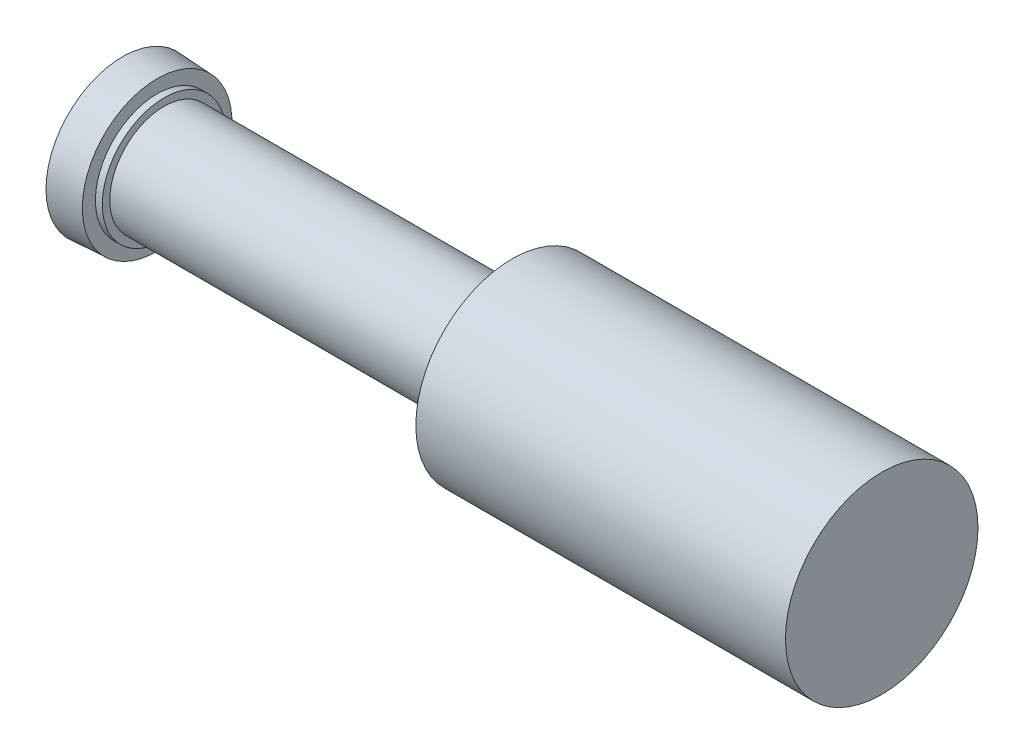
SolidWorks part; units mm, degrees
ref_plane "Front Plane" through (0, 0, 0) normal (0, 0, 1) x (1, 0, 0)
ref_plane "Top Plane" through (0, 0, 0) normal (0, 1, 0) x (1, 0, 0)
ref_plane "Right Plane" through (0, 0, 0) normal (1, 0, 0) x (0, 0, -1)
sketch "Sketch1" plane through (0, 0, 0) normal (1, 0, 0) x (0, 0, -1)
  circle A0 centre (0, 0) radius 6.975
  dimension "D1" = 13.95
extrude "Boss-Extrude1" add sketch "Sketch1" along normal mid plane 55
sketch "Sketch2" plane through (-27.5, 0, 0) normal (-1, 0, 0) x (0, 0, 1)
  circle A0 centre (0, 0) radius 5.55
  circle A1 centre (0, 0) radius 6.975 construction
  circle A2 centre (0, 0) radius 6.975
  dimension "D1" = 11.1
extrude "Cut-Extrude1" cut sketch "Sketch2" against normal blind 2.5 draft 3
sketch "Sketch6" plane through (-25, 0, 0) normal (-1, 0, 0) x (0, 0, 1)
  circle A0 centre (0, 0) radius 4.47
  circle A1 centre (0, 0) radius 6.975 construction
  circle A2 centre (0, 0) radius 6.975
  dimension "D1" = 8.94
extrude "Cut-Extrude2" cut sketch "Sketch6" against normal blind 0.5
sketch "Sketch7" plane through (-24.5, 0, 0) normal (-1, 0, 0) x (0, 0, 1)
  circle A0 centre (0, 0) radius 6.975 construction
  circle A1 centre (0, 0) radius 6.975
  circle A2 centre (0, 0) radius 3.93
  dimension "D1" = 7.86
extrude "Cut-Extrude3" cut sketch "Sketch7" against normal blind 25.22
